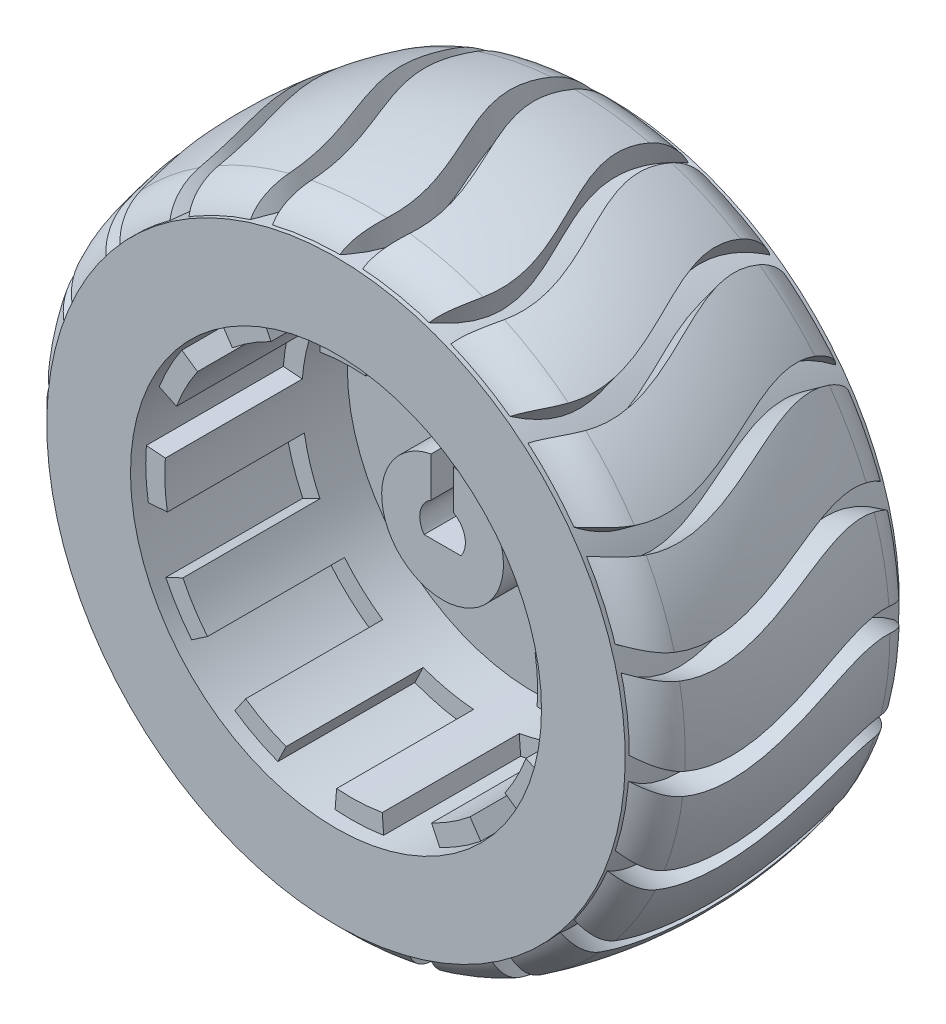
SolidWorks part; units mm, degrees
ref_plane "Front Plane" through (0, 0, 0) normal (0, 0, 1) x (1, 0, 0)
ref_plane "Top Plane" through (0, 0, 0) normal (0, 1, 0) x (1, 0, 0)
ref_plane "Right Plane" through (0, 0, 0) normal (1, 0, 0) x (0, 0, -1)
sketch "Sketch1" plane through (0, 0, 0) normal (0, 0, 1) x (1, 0, 0)
  circle A0 centre (0, 0) radius 13.5
  circle A1 centre (0, 0) radius 21.5
  circle A2 centre (0, 0) radius 20
  dimension "D1" = 27
  dimension "D2" = 43
  dimension "D3" = 40
extrude "Boss-Extrude1" add sketch "Sketch1" along normal blind 18 contours A2 A0
sketch "Sketch2" plane through (0, 0, 0) normal (1, 0, 0) x (0, 0, -1)
  line L0 (0, 21.5) -> (-19.4402, 21.5) construction
  line L1 (0, 21.5) -> (0, -21.5) construction
  line L2 (-9, 20) -> (-9, 25.6724) construction
  line L3 (0, 20) -> (-18, 20) construction
  line L5 (0, 20) -> (-18, 20)
  line L6 (-18, 0) -> (0, 0) construction
  line L7 (-18, 20) -> (-18, -20) construction
  spline S0 degree 2 poles (0, 20) (-9, 23) (-18, 20) knots 0 0 0 1 1 1
  dimension "D1" = 21.5
revolve "Revolve1" add sketch "Sketch2" angle 360 about L6
sketch "Sketch3" plane through (0, 0, 0) normal (0, 1, 0) x (1, 0, 0)
  line L0 (0.2444, -3.1375) -> (0.2444, -4.5) construction
  line L1 (1.7444, -3.1375) -> (1.7444, -4.5) construction
  line L2 (-1.2556, -14.8625) -> (-1.2556, -13.5) construction
  line L3 (-1.2556, 0) -> (0.2444, 0)
  line L4 (-1.2556, -18) -> (0.2444, -18)
  line L6 (-2.7556, -13.5) -> (-2.7556, -14.8625) construction
  line L13 (0, -18) -> (0, 0) construction
  spline S0 degree 3 poles (0.2444, 0) (2.9111, -3) (0.2444, -9) (-2.4222, -15) (0.2444, -18) knots 0 0 0 0 0.5 1 1 1 1
  spline S1 degree 3 poles (-1.2556, 0) (1.4111, -3) (-1.2556, -9) (-3.9222, -15) (-1.2556, -18) knots 0 0 0 0 0.5 1 1 1 1
  dimension "D1" = 1.5
extrude "Cut-Extrude1" cut sketch "Sketch3" against normal through all
sketch "Sketch9" plane through (0, 0, 0) normal (0, 0, 1) x (1, 0, 0)
  circle A0 centre (0, 0) radius 19
  dimension "D1" = 38
extrude "Boss-Extrude8" add sketch "Sketch9" along normal blind 18
fillet "Fillet3" radius 3 2 edges at (0.5059, 19.9936, 18) (0.5059, 19.9936, 0)
sketch "Sketch10" plane through (0, 0, 0) normal (0, 0, 1) x (1, 0, 0)
  circle A0 centre (0, 0) radius 17.7514
extrude "Cut-Extrude4" cut sketch "Sketch10" along normal through all both and the other way through all
pattern_circular "CirPattern5" count 20 over 360 about axis through (0, 0, 18) along (0, 0, -1) of "Boss-Extrude8", "Cut-Extrude1"
sketch "Sketch12" plane through (0, 0, 0) normal (0, 0, 1) x (1, 0, 0)
  circle A0 centre (0, 0) radius 13.5
  dimension "D1" = 27
extrude "Cut-Extrude6" cut sketch "Sketch12" along normal through all both and the other way through all
sketch "Sketch14" plane through (0, 0, 0) normal (0, 0, -1) x (-1, 0, 0)
  circle A0 centre (0, 0) radius 13.5
extrude "Boss-Extrude9" add sketch "Sketch14" against normal blind 5
sketch "Sketch15" plane through (0, 0, 0) normal (0, 0, -1) x (-1, 0, 0)
  circle A0 centre (0, 0) radius 13.5
extrude "Cut-Extrude7" cut sketch "Sketch15" against normal blind 3
sketch "Sketch16" plane through (0, 0, 0) normal (0, 0, -1) x (-1, 0, 0)
  circle A0 centre (0, 0) radius 14
  dimension "D1" = 28
extrude "Cut-Extrude8" cut sketch "Sketch16" against normal blind 2.8
sketch "Sketch17" plane through (0, 0, 5) normal (0, 0, 1) x (1, 0, 0)
  circle A0 centre (0, 0) radius 4
  dimension "D1" = 8
extrude "Boss-Extrude11" add sketch "Sketch17" along normal blind 6
sketch "Sketch18" plane through (0, 0, 5) normal (0, 0, 1) x (1, 0, 0)
  circle A0 centre (0, 0) radius 13.5
  circle A1 centre (0, 0) radius 12.25
  dimension "D1" = 24.5
extrude "Boss-Extrude12" add sketch "Sketch18" along normal blind 3
sketch "Sketch20" plane through (0, 0, 8) normal (0, 0, 1) x (1, 0, 0)
  line L1 (12.0789, 2.04) -> (13.3309, 2.1301)
  line L2 (12.2123, -0.96) -> (13.4585, -1.0579)
  circle A0 centre (0, 0) radius 12.25 construction
  circle A1 centre (0, 0) radius 13.5
  circle A2 centre (0, 0) radius 13.5 construction
  circle A3 centre (0, 0) radius 12.25
  dimension "D1" = 3
sketch "Sketch21" plane through (0, 0, 8) normal (0, 0, 1) x (1, 0, 0)
extrude "Boss-Extrude18" add sketch "Sketch20" along normal blind 9 contours A1 L2 A0 L1
pattern_circular "CirPattern6" count 12 over 360 about axis through (0, 0, 0) along (0, 0, 1) of "Boss-Extrude18"
sketch "Sketch22" plane through (0, 0, 3) normal (0, 0, -1) x (-1, 0, 0)
  circle A0 centre (0, 0) radius 11
  dimension "D1" = 22
extrude "Cut-Extrude9" cut sketch "Sketch22" against normal blind 1
sketch "Sketch23" plane through (0, 0, 4) normal (0, 0, -1) x (-1, 0, 0)
  circle A0 centre (0, 0) radius 3.5
  dimension "D1" = 7
extrude "Boss-Extrude19" add sketch "Sketch23" along normal blind 0.75
sketch "Sketch24" plane through (0, 0, 3.25) normal (0, 0, -1) x (-1, 0, 0)
  line L0 (-1.2093, -0.8874) -> (1.2093, -0.8874)
  line L1 (0, 0) -> (0, 5.4126) construction
  line L2 (-0.72, 1.3159) -> (-0.72, 5.4126)
  line L3 (0.75, 1.299) -> (0.75, 5.4126)
  line L4 (-0.72, 5.4126) -> (0.75, 5.4126)
  arc A0 (-0.72, 1.3159) -> (-1.2093, -0.8874) centre (0, 0) ccw
  arc A1 (1.2093, -0.8874) -> (0.75, 1.299) centre (0, 0) ccw
  dimension "D1" = 3
  dimension "D2" = 0.75
  dimension "D3" = 0.72
extrude "Cut-Extrude14" cut sketch "Sketch24" against normal through all both and the other way through all
